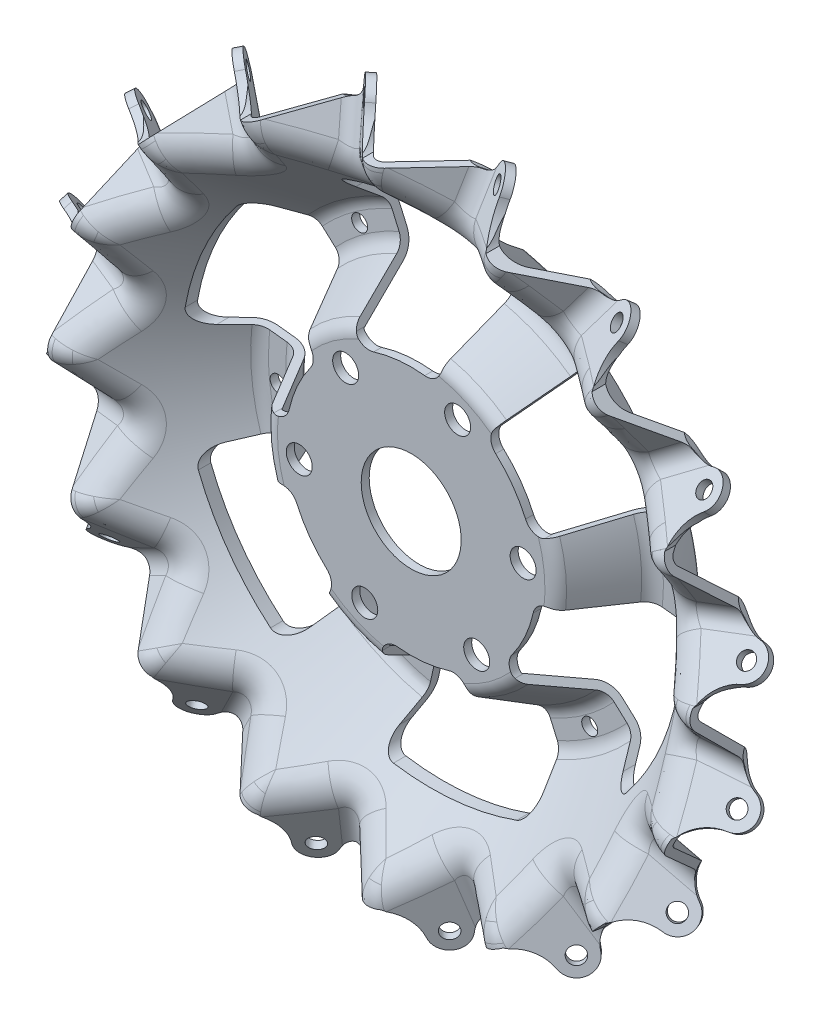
SolidWorks part; units mm, degrees
other "\\X2\\522096649762\\X0\\4"
ref_plane "前视基准面" through (0, 0, 0) normal (0, 0, 1) x (1, 0, 0)
ref_plane "上视基准面" through (0, 0, 0) normal (0, 1, 0) x (1, 0, 0)
ref_plane "右视基准面" through (0, 0, 0) normal (1, 0, 0) x (0, 0, -1)
imported_body "输入1"
sketch "草图1" plane through (0, 0, 12.7) normal (0, 0, 1) x (1, 0, 0)
  line L0 (-1.8552, 64.1694) -> (12.8886, 64.667)
  line L1 (22.8425, 59.9948) -> (36.6545, 54.8123)
  line L2 (16.7582, 72.2531) -> (22.838, 69.3228)
  line L3 (43.1326, 60.34) -> (47.6282, 55.3062)
  line L4 (21.7504, 64.1876) -> (22.838, 69.3228)
  line L5 (40.3385, 56.4882) -> (43.1326, 60.34)
  line L6 (44.0628, 46.6865) -> (54.8401, 36.6129)
  line L7 (62.9405, 39.2408) -> (65.1675, 32.8697)
  line L8 (44.6583, 50.9781) -> (47.6282, 55.3062)
  line L9 (58.885, 36.7514) -> (62.9405, 39.2408)
  line L10 (58.5748, 26.2706) -> (64.6768, 12.8395)
  line L11 (73.1662, 12.1675) -> (72.7856, 5.4291)
  line L12 (60.7673, 30.0077) -> (65.1675, 32.8697)
  line L13 (68.4668, 11.4196) -> (73.1662, 12.1675)
  line L14 (64.1694, 1.8552) -> (64.667, -12.8886)
  line L15 (72.2531, -16.7582) -> (69.3228, -22.838)
  line L16 (67.6252, 4.4688) -> (72.7856, 5.4291)
  line L17 (67.6252, -15.6508) -> (72.2531, -16.7582)
  line L18 (59.9948, -22.8425) -> (54.8123, -36.6545)
  line L19 (60.34, -43.1326) -> (55.3062, -47.6282)
  line L20 (64.1876, -21.7504) -> (69.3228, -22.838)
  line L21 (56.4882, -40.3385) -> (60.34, -43.1326)
  line L22 (46.6865, -44.0628) -> (36.6129, -54.8401)
  line L23 (39.2408, -62.9405) -> (32.8697, -65.1675)
  line L24 (50.9781, -44.6583) -> (55.3062, -47.6282)
  line L25 (36.7514, -58.885) -> (39.2408, -62.9405)
  line L26 (26.2706, -58.5748) -> (12.8395, -64.6768)
  line L27 (12.1675, -73.1662) -> (5.4291, -72.7856)
  line L28 (30.0077, -60.7673) -> (32.8697, -65.1675)
  line L29 (11.4196, -68.4668) -> (12.1675, -73.1662)
  line L30 (1.8552, -64.1694) -> (-12.8886, -64.667)
  line L31 (-16.7582, -72.2531) -> (-22.838, -69.3228)
  line L32 (4.4688, -67.6252) -> (5.4291, -72.7856)
  line L33 (-15.6508, -67.6252) -> (-16.7582, -72.2531)
  line L34 (-22.8425, -59.9948) -> (-36.6545, -54.8123)
  line L35 (-43.1326, -60.34) -> (-47.6282, -55.3062)
  line L36 (-21.7504, -64.1876) -> (-22.838, -69.3228)
  line L37 (-40.3385, -56.4882) -> (-43.1326, -60.34)
  line L38 (-44.0628, -46.6865) -> (-54.8401, -36.6129)
  line L39 (-62.9405, -39.2408) -> (-65.1675, -32.8697)
  line L40 (-44.6583, -50.9781) -> (-47.6282, -55.3062)
  line L41 (-58.885, -36.7514) -> (-62.9405, -39.2408)
  line L42 (-58.5748, -26.2706) -> (-64.6768, -12.8395)
  line L43 (-73.1662, -12.1675) -> (-72.7856, -5.4291)
  line L44 (-60.7673, -30.0077) -> (-65.1675, -32.8697)
  line L45 (-68.4668, -11.4196) -> (-73.1662, -12.1675)
  line L46 (-64.1694, -1.8552) -> (-64.667, 12.8886)
  line L47 (-72.2531, 16.7582) -> (-69.3228, 22.838)
  line L48 (-67.6252, -4.4688) -> (-72.7856, -5.4291)
  line L49 (-67.6252, 15.6508) -> (-72.2531, 16.7582)
  line L50 (-59.9948, 22.8425) -> (-54.8123, 36.6545)
  line L51 (-60.34, 43.1326) -> (-55.3062, 47.6282)
  line L52 (-64.1876, 21.7504) -> (-69.3228, 22.838)
  line L53 (-56.4882, 40.3385) -> (-60.34, 43.1326)
  line L54 (-46.6865, 44.0628) -> (-36.6129, 54.8401)
  line L55 (-39.2408, 62.9405) -> (-32.8697, 65.1675)
  line L56 (-50.9781, 44.6583) -> (-55.3062, 47.6282)
  line L57 (-36.7514, 58.885) -> (-39.2408, 62.9405)
  line L58 (-26.2706, 58.5748) -> (-12.8395, 64.6768)
  line L59 (-12.1675, 73.1662) -> (-5.4291, 72.7856)
  line L60 (-30.0077, 60.7673) -> (-32.8697, 65.1675)
  line L61 (-11.4196, 68.4668) -> (-12.1675, 73.1662)
  line L62 (-4.4688, 67.6252) -> (-5.4291, 72.7856)
  line L63 (15.6508, 67.6252) -> (16.7582, 72.2531)
  arc A0 (22.8425, 59.9948) -> (21.7504, 64.1876) centre (26.4905, 63.1837) cw
  arc A1 (-1.8552, 64.1694) -> (-4.4688, 67.6252) centre (0.2946, 68.5116) cw
  arc A2 (12.8886, 64.667) -> (15.6508, 67.6252) centre (12.0631, 68.2066) ccw
  arc A3 (36.6545, 54.8123) -> (40.3385, 56.4882) centre (37.2463, 58.3983) ccw
  arc A4 (44.0628, 46.6865) -> (44.6583, 50.9781) centre (48.6533, 48.2366) cw
  arc A5 (54.8401, 36.6129) -> (58.885, 36.7514) centre (56.7592, 39.6995) ccw
  arc A6 (58.5748, 26.2706) -> (60.7673, 30.0077) centre (63.4092, 25.946) cw
  arc A7 (64.6768, 12.8395) -> (68.4668, 11.4196) centre (67.631, 14.9567) ccw
  arc A8 (64.1694, 1.8552) -> (67.6252, 4.4688) centre (68.5116, -0.2946) cw
  arc A9 (64.667, -12.8886) -> (67.6252, -15.6508) centre (68.2066, -12.0631) ccw
  arc A10 (59.9948, -22.8425) -> (64.1876, -21.7504) centre (63.1837, -26.4905) cw
  arc A11 (54.8123, -36.6545) -> (56.4882, -40.3385) centre (58.3983, -37.2463) ccw
  arc A12 (46.6865, -44.0628) -> (50.9781, -44.6583) centre (48.2366, -48.6533) cw
  arc A13 (36.6129, -54.8401) -> (36.7514, -58.885) centre (39.6995, -56.7592) ccw
  arc A14 (26.2706, -58.5748) -> (30.0077, -60.7673) centre (25.946, -63.4092) cw
  arc A15 (12.8395, -64.6768) -> (11.4196, -68.4668) centre (14.9567, -67.631) ccw
  arc A16 (1.8552, -64.1694) -> (4.4688, -67.6252) centre (-0.2946, -68.5116) cw
  arc A17 (-12.8886, -64.667) -> (-15.6508, -67.6252) centre (-12.0631, -68.2066) ccw
  arc A18 (-22.8425, -59.9948) -> (-21.7504, -64.1876) centre (-26.4905, -63.1837) cw
  arc A19 (-36.6545, -54.8123) -> (-40.3385, -56.4882) centre (-37.2463, -58.3983) ccw
  arc A20 (-44.0628, -46.6865) -> (-44.6583, -50.9781) centre (-48.6533, -48.2366) cw
  arc A21 (-54.8401, -36.6129) -> (-58.885, -36.7514) centre (-56.7592, -39.6995) ccw
  arc A22 (-58.5748, -26.2706) -> (-60.7673, -30.0077) centre (-63.4092, -25.946) cw
  arc A23 (-64.6768, -12.8395) -> (-68.4668, -11.4196) centre (-67.631, -14.9567) ccw
  arc A24 (-64.1694, -1.8552) -> (-67.6252, -4.4688) centre (-68.5116, 0.2946) cw
  arc A25 (-64.667, 12.8886) -> (-67.6252, 15.6508) centre (-68.2066, 12.0631) ccw
  arc A26 (-59.9948, 22.8425) -> (-64.1876, 21.7504) centre (-63.1837, 26.4905) cw
  arc A27 (-54.8123, 36.6545) -> (-56.4882, 40.3385) centre (-58.3983, 37.2463) ccw
  arc A28 (-46.6865, 44.0628) -> (-50.9781, 44.6583) centre (-48.2366, 48.6533) cw
  arc A29 (-36.6129, 54.8401) -> (-36.7514, 58.885) centre (-39.6995, 56.7592) ccw
  arc A30 (-26.2706, 58.5748) -> (-30.0077, 60.7673) centre (-25.946, 63.4092) cw
  arc A31 (-12.8395, 64.6768) -> (-11.4196, 68.4668) centre (-14.9567, 67.631) ccw
  point P128 (0, 0)
extrude "切除-拉伸1" cut sketch "草图1" against normal mid plane 20 flip side to cut
sketch "草图2" plane through (0, 0, 12.7) normal (0, 0, 1) x (1, 0, 0)
  line L0 (9.2859, 20.4944) -> (22.3917, 2.2054) construction
  line L1 (27.6667, -3.0911) -> (46.6141, -5.208)
  line L2 (0, 0) -> (63.0886, 45.2086) construction
  line L3 (20.5659, -18.7628) -> (34.6504, -31.6125)
  line L4 (11.1564, -25.5056) -> (18.7968, -42.973)
  line L5 (26.532, 8.4292) -> (44.7024, 14.2019)
  line L6 (16.5103, 22.4145) -> (27.8173, 37.765)
  line L7 (-5.9661, -27.192) -> (-10.052, -45.8144)
  line L8 (-16.5103, -22.4145) -> (-27.8173, -37.765)
  line L9 (-26.532, -8.4292) -> (-44.7024, -14.2019)
  line L10 (-27.6667, 3.0911) -> (-46.6141, 5.208)
  line L11 (-20.5659, 18.7628) -> (-34.6504, 31.6125)
  line L12 (-11.1564, 25.5056) -> (-18.7968, 42.973)
  line L13 (5.9661, 27.192) -> (10.052, 45.8144)
  arc A0 (46.5894, 18.1501) -> (32.1625, 38.2828) centre (0, 0) ccw
  arc A1 (22.8783, 10.0789) -> (16.898, 18.4244) centre (0, 0) ccw
  arc A2 (44.7024, 14.2019) -> (46.5894, 18.1501) centre (43.7941, 17.0611) ccw
  arc A3 (27.8173, 37.765) -> (32.1625, 38.2828) centre (30.2328, 35.9858) cw
  arc A4 (16.898, 18.4244) -> (16.5103, 22.4145) centre (18.9258, 20.6353) cw
  arc A5 (22.8783, 10.0789) -> (26.532, 8.4292) centre (25.6237, 11.2884) ccw
  arc A6 (39.0132, -31.2726) -> (49.2351, -8.7122) centre (0, 0) ccw
  arc A7 (34.6504, -31.6125) -> (39.0132, -31.2726) centre (36.6724, -29.3962) ccw
  arc A8 (20.1677, -14.7737) -> (24.405, -5.4219) centre (0, 0) ccw
  arc A9 (20.1677, -14.7737) -> (20.5659, -18.7628) centre (22.5879, -16.5466) ccw
  arc A10 (24.405, -5.4219) -> (27.6667, -3.0911) centre (27.3336, -6.0725) cw
  arc A11 (46.6141, -5.208) -> (49.2351, -8.7122) centre (46.281, -8.1895) cw
  arc A12 (-7.5763, -49.4227) -> (17.0726, -46.995) centre (0, 0) ccw
  arc A13 (-10.052, -45.8144) -> (-7.5763, -49.4227) centre (-7.1217, -46.4573) ccw
  arc A14 (-2.7106, -24.8526) -> (7.507, -23.8463) centre (0, 0) ccw
  arc A15 (-2.7106, -24.8526) -> (-5.9661, -27.192) centre (-3.0358, -27.8349) ccw
  arc A16 (7.507, -23.8463) -> (11.1564, -25.5056) centre (8.4078, -26.7078) cw
  arc A17 (18.7968, -42.973) -> (17.0726, -46.995) centre (16.0482, -44.1753) cw
  arc A18 (-46.5894, -18.1501) -> (-32.1625, -38.2828) centre (0, 0) ccw
  arc A19 (-44.7024, -14.2019) -> (-46.5894, -18.1501) centre (-43.7941, -17.0611) ccw
  arc A20 (-22.8783, -10.0789) -> (-16.898, -18.4244) centre (0, 0) ccw
  arc A21 (-22.8783, -10.0789) -> (-26.532, -8.4292) centre (-25.6237, -11.2884) ccw
  arc A22 (-16.898, -18.4244) -> (-16.5103, -22.4145) centre (-18.9258, -20.6353) cw
  arc A23 (-27.8173, -37.765) -> (-32.1625, -38.2828) centre (-30.2328, -35.9858) cw
  arc A24 (-39.0132, 31.2726) -> (-49.2351, 8.7122) centre (0, 0) ccw
  arc A25 (-34.6504, 31.6125) -> (-39.0132, 31.2726) centre (-36.6724, 29.3962) ccw
  arc A26 (-20.1677, 14.7737) -> (-24.405, 5.4219) centre (0, 0) ccw
  arc A27 (-20.1677, 14.7737) -> (-20.5659, 18.7628) centre (-22.5879, 16.5466) ccw
  arc A28 (-24.405, 5.4219) -> (-27.6667, 3.0911) centre (-27.3336, 6.0725) cw
  arc A29 (-46.6141, 5.208) -> (-49.2351, 8.7122) centre (-46.281, 8.1895) cw
  arc A30 (7.5763, 49.4227) -> (-17.0726, 46.995) centre (0, 0) ccw
  arc A31 (10.052, 45.8144) -> (7.5763, 49.4227) centre (7.1217, 46.4573) ccw
  arc A32 (2.7106, 24.8526) -> (-7.507, 23.8463) centre (0, 0) ccw
  arc A33 (2.7106, 24.8526) -> (5.9661, 27.192) centre (3.0358, 27.8349) ccw
  arc A34 (-7.507, 23.8463) -> (-11.1564, 25.5056) centre (-8.4078, 26.7078) cw
  arc A35 (-18.7968, 42.973) -> (-17.0726, 46.995) centre (-16.0482, 44.1753) cw
  circle A37 centre (-16.3019, -35.9791) radius 1.6
  circle A38 centre (-23.0079, 32.1074) radius 1.6
  circle A39 centre (16.3019, 35.9791) radius 1.6
  circle A40 centre (23.0079, -32.1074) radius 1.6
  point P1 (3.4802, 28.9723)
  point P77 (0, 0)
  point P87 (0, 0)
  point P93 (0, 0)
extrude "切除-拉伸2" cut sketch "草图2" against normal blind 20
sketch "草图5" plane through (6.6154, 12.5704, 14.1451) normal (0.33, 0.6271, 0.7056) x (0.944, -0.2192, -0.2467)
  line L0 (60.8513, -11.8904) -> (70.1869, -11.8904)
  line L1 (70.1869, -11.8904) -> (70.1869, -37.228)
  line L2 (70.1869, -37.228) -> (57.0717, -30.1309)
  line L3 (60.4613, -14.2757) -> (60.4613, -11.8904)
  line L4 (60.4613, -11.8904) -> (60.8513, -11.8904)
  arc A0 (63.3134, -26.0227) -> (64.1956, -19.2577) centre (62.9773, -22.5388) ccw
  arc A1 (60.4613, -14.2757) -> (64.1956, -19.2577) centre (66.4327, -13.6904) ccw
  arc A2 (57.0717, -30.1309) -> (63.3134, -26.0227) centre (64.0818, -33.9857) cw
  dimension "D1" = 7
  dimension "D2" = 6
  dimension "D3" = 8
extrude "切除-拉伸3" cut sketch "草图5" against normal mid plane 20
pattern_circular "阵列(圆周)1" count 16 over 360 about axis through (0, 0, 0) along (0, 0, 1) of "切除-拉伸3"
